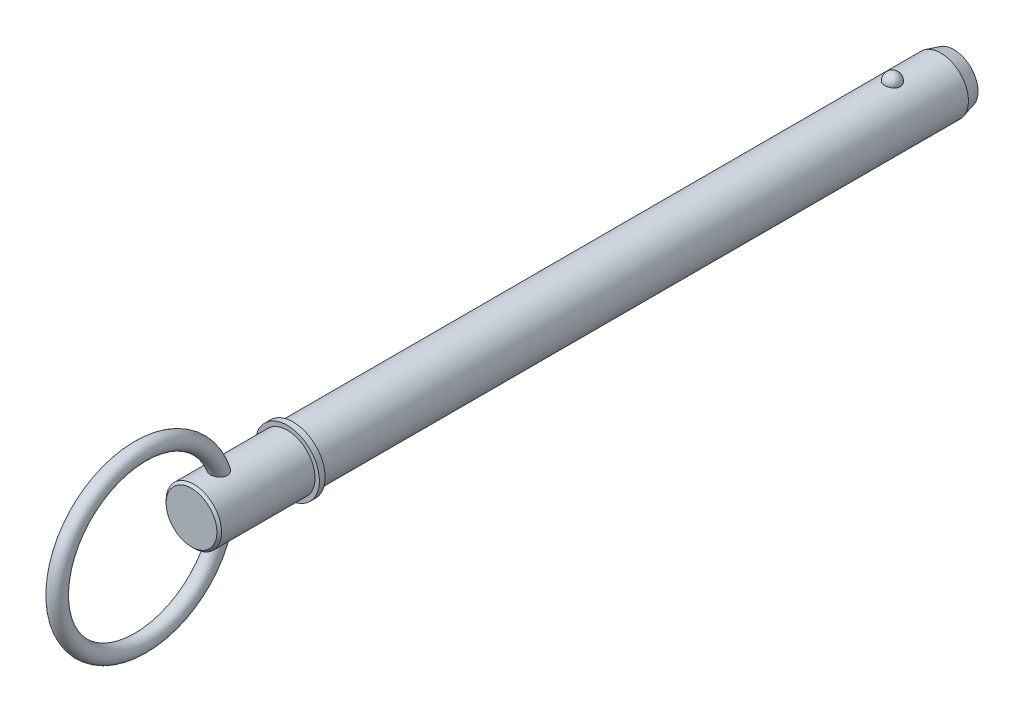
SolidWorks part; units mm, degrees
ref_plane "Front Plane" through (0, 0, 0) normal (0, 0, 1) x (1, 0, 0)
ref_plane "Top Plane" through (0, 0, 0) normal (0, 1, 0) x (1, 0, 0)
ref_plane "Right Plane" through (0, 0, 0) normal (1, 0, 0) x (0, 0, -1)
sketch "Sketch2" plane through (0, 0, 0) normal (0, 0, 1) x (1, 0, 0)
  circle A0 centre (0, 0) radius 9.525
  point P3 (0, 9.525)
  dimension "D1" = 19.05
extrude "Boss-Extrude1" add sketch "Sketch2" along normal blind 203.2
sketch "Sketch3" plane through (0, 0, 0) normal (0, 0, -1) x (-1, 0, 0)
  circle A0 centre (0, 0) radius 9.525
  dimension "D1" = 19.05
extrude "Boss-Extrude2" add sketch "Sketch3" along normal blind 23.8
chamfer "Chamfer1" distance 4.5 angle 15 1 edges at (-9.525, 0, -23.8)
sketch "Sketch18" plane through (0, 0, 0) normal (1, 0, 0) x (0, 0, -1)
  line L0 (19.3, 9.525) -> (-203.2, 9.525) construction
  line L1 (2.69, 12.215) -> (2.69, 6.835)
  line L2 (-203.2, -9.525) -> (19.3, -9.525) construction
  arc A0 (2.69, 12.215) -> (2.69, 6.835) centre (2.69, 9.525) ccw
  point P4 (0, 9.525)
  dimension "D1" = 21.74
revolve "Revolve1" add sketch "Sketch18" angle 360 about L1
sketch "Sketch19" plane through (0, 0, 0) normal (1, 0, 0) x (0, 0, -1)
  line L0 (-33.7288, 0) -> (-46.4542, 0) construction
sketch "Sketch20" plane through (0, 0, 0) normal (1, 0, 0) x (0, 0, -1)
  line L0 (-203.2, 0) -> (-203.2, 11)
  line L1 (-203.2, 9.525) -> (-203.2, -9.525) construction
  line L2 (-203.2, 11) -> (-205.2, 11)
  line L3 (-205.2, 11) -> (-205.2, 0)
  line L4 (-33.7288, 0) -> (-46.4542, 0) construction
  line L5 (-205.2, 0) -> (-203.2, 0)
  dimension "D1" = 11
  dimension "D2" = 2
revolve "Revolve2" add sketch "Sketch20" angle 360 about L0
sketch "Sketch21" plane through (0, 0, 203.2) normal (0, 0, -1) x (-1, 0, 0)
  circle A0 centre (0, 0) radius 9.525
  dimension "D1" = 19.05
extrude "Boss-Extrude3" add sketch "Sketch21" against normal blind 34.93
chamfer "Chamfer2" distance 0.8 angle 45 1 edges at (-9.525, 0, 238.13)
sketch "Sketch23" plane through (0, 0, 0) normal (1, 0, 0) x (0, 0, -1)
  line L0 (-238.13, 8.725) -> (-238.13, -8.725) construction
  circle A0 centre (-255.705, 0) radius 28.575
  point P2 (-227.13, 0)
  dimension "D1" = 57.15
  dimension "D2" = 11
sketch "Sketch24" plane through (0, 0, 0) normal (0, 1, 0) x (1, 0, 0)
  circle A0 centre (0, -227.13) radius 2.75
  dimension "D1" = 5.5
sweep "Sweep1" add profiles "Sketch24" path "Sketch23"
